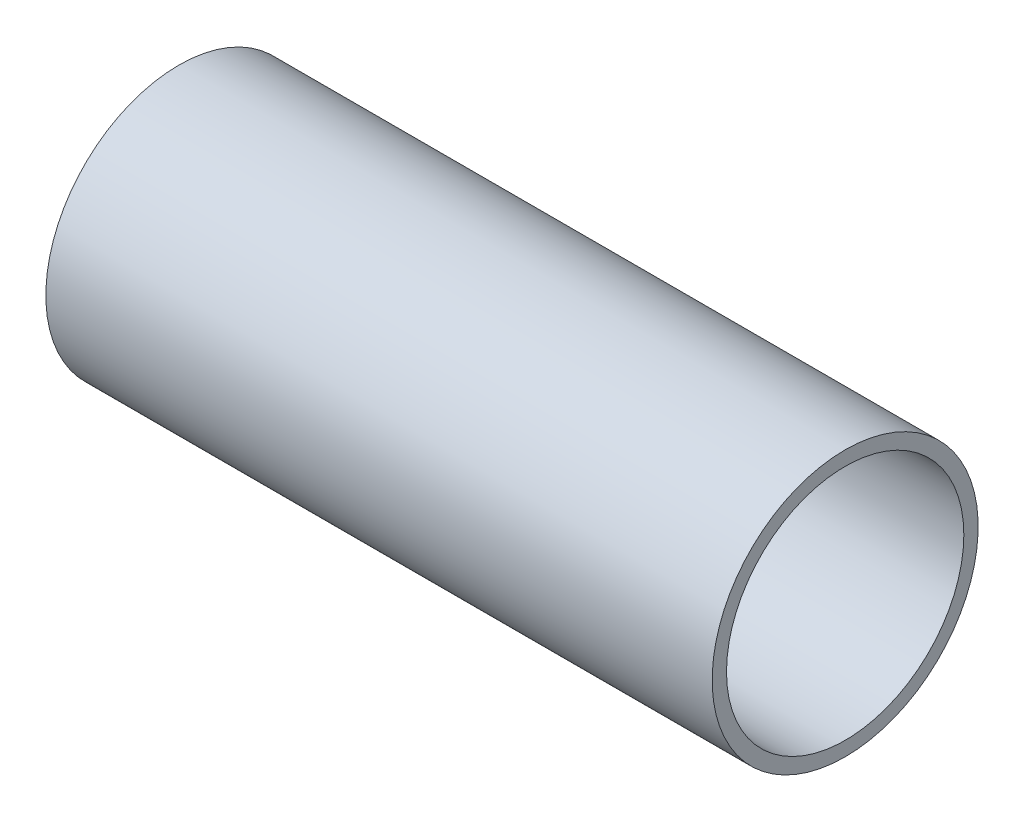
SolidWorks part; units mm, degrees
ref_plane "Plan de face" through (0, 0, 0) normal (0, 0, 1) x (1, 0, 0)
ref_plane "Plan de dessus" through (0, 0, 0) normal (0, 1, 0) x (1, 0, 0)
ref_plane "Plan de droite" through (0, 0, 0) normal (1, 0, 0) x (0, 0, -1)
sketch "Esquisse2" plane through (557, 0, 0) normal (1, 0, 0) x (0, 0, -1)
  circle A0 centre (0, -415) radius 24.15 construction
  circle A1 centre (0, -415) radius 24.15
extrude "Extru.-Mince1" add sketch "Esquisse2" along normal blind 121 thin
